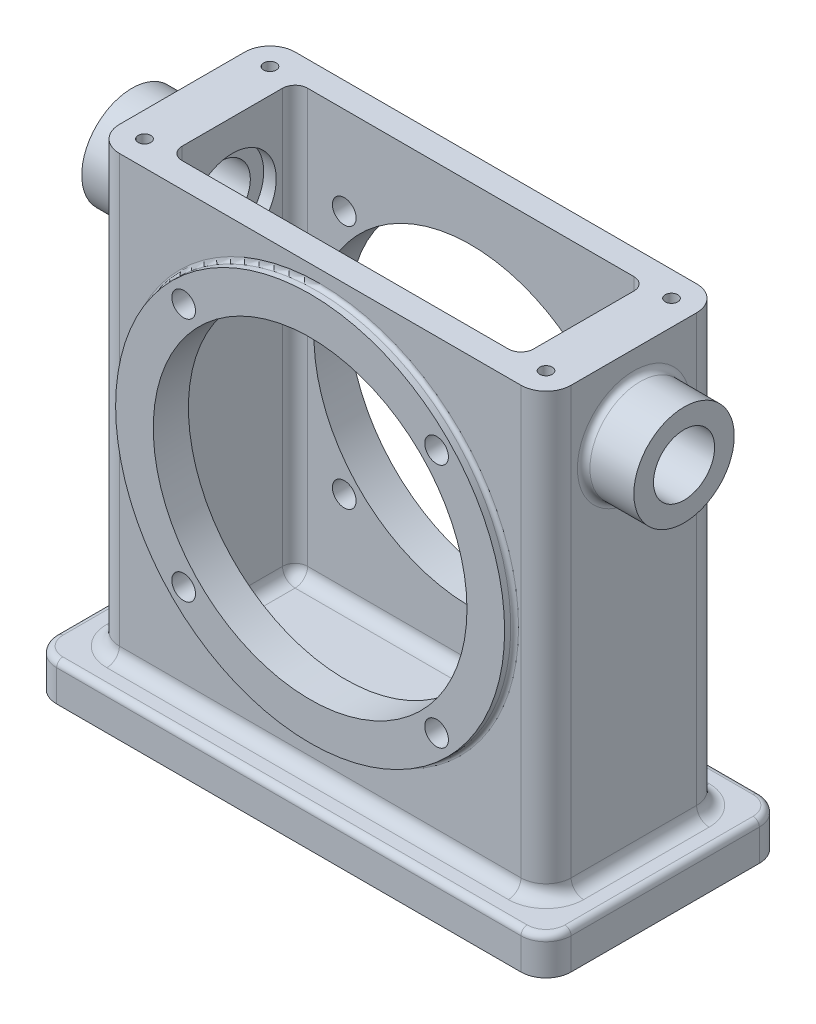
SolidWorks part; units mm, degrees
ref_plane "Front" through (0, 0, 0) normal (0, 0, 1) x (1, 0, 0)
ref_plane "Top" through (0, 0, 0) normal (0, 1, 0) x (1, 0, 0)
ref_plane "Right" through (0, 0, 0) normal (1, 0, 0) x (0, 0, -1)
sketch "Sketch1" plane through (0, 0, 0) normal (0, 1, 0) x (1, 0, 0)
  line L0 (-65.0875, -30.1625) -> (65.0875, 30.1625) construction
  line L1 (-65.0875, -30.1625) -> (65.0875, -30.1625)
  line L2 (-65.0875, -30.1625) -> (-65.0875, 30.1625)
  line L3 (-65.0875, 30.1625) -> (65.0875, 30.1625)
  line L4 (65.0875, -30.1625) -> (65.0875, 30.1625)
  dimension "D1" = 130.175
  dimension "D2" = 60.325
extrude "Base-Extrude" add sketch "Sketch1" along normal blind 9.525
sketch "Sketch2" plane through (0, 9.525, 0) normal (0, 1, 0) x (-1, 0, 0)
  line L0 (57.15, 22.225) -> (-57.15, -22.225) construction
  line L1 (57.15, 22.225) -> (-57.15, 22.225)
  line L2 (57.15, 22.225) -> (57.15, -22.225)
  line L3 (57.15, -22.225) -> (-57.15, -22.225)
  line L4 (-57.15, 22.225) -> (-57.15, -22.225)
  dimension "D1" = 114.3
  dimension "D2" = 44.45
extrude "Boss-Extrude1" add sketch "Sketch2" along normal blind 111.125
fillet "Fillet1" radius 6.35 8 edges at (-57.15, 65.0875, -22.225) (-57.15, 65.0875, 22.225) (57.15, 65.0875, 22.225) (57.15, 65.0875, -22.225) (-65.0875, 4.7625, -30.1625) (65.0875, 4.7625, -30.1625) (65.0875, 4.7625, 30.1625) (-65.0875, 4.7625, 30.1625)
fillet "Fillet2" radius 1.5875 8 edges at (0, 9.525, 30.1625) (-65.0875, 9.525, 0) (65.0875, 9.525, 0) (0, 9.525, -30.1625) (-63.2276, 9.525, -28.3026) (63.2276, 9.525, 28.3026) (63.2276, 9.525, -28.3026) (-63.2276, 9.525, 28.3026)
fillet "Fillet3" radius 3.175 8 edges at (-57.15, 9.525, 0) (0, 9.525, -22.225) (57.15, 9.525, 0) (0, 9.525, 22.225) (-55.2901, 9.525, 20.3651) (-55.2901, 9.525, -20.3651) (55.2901, 9.525, 20.3651) (55.2901, 9.525, -20.3651)
sketch "Sketch3" plane through (0, 120.65, 0) normal (0, 1, 0) x (-1, 0, 0)
  line L2 (50.8, 15.875) -> (-50.8, 15.875)
  line L3 (41.275, 15.875) -> (-41.275, 15.875)
  line L5 (-50.8, -15.875) -> (50.8, -15.875)
  line L6 (-41.275, -15.875) -> (41.275, -15.875)
  line L8 (44.45, -15.875) -> (44.45, 15.875)
  line L9 (44.45, -12.7) -> (44.45, 12.7)
  line L11 (-44.45, 15.875) -> (-44.45, -15.875)
  line L12 (-44.45, 12.7) -> (-44.45, -12.7)
  arc A0 (-41.275, 15.875) -> (-44.45, 12.7) centre (-41.275, 12.7) ccw
  arc A1 (44.45, 12.7) -> (41.275, 15.875) centre (41.275, 12.7) ccw
  arc A2 (41.275, -15.875) -> (44.45, -12.7) centre (41.275, -12.7) ccw
  arc A3 (-44.45, -12.7) -> (-41.275, -15.875) centre (-41.275, -12.7) ccw
  dimension "D5" = 3.175
  dimension "D1" = 6.35
  dimension "D2" = 6.35
  dimension "D3" = 12.7
  dimension "D4" = 12.7
extrude "Cut-Extrude1" cut sketch "Sketch3" against normal blind 107.95
fillet "Fillet4" radius 3.175 8 edges at (43.5201, 12.7, 14.9451) (0, 12.7, 15.875) (-43.5201, 12.7, 14.9451) (-44.45, 12.7, 0) (-43.5201, 12.7, -14.9451) (0, 12.7, -15.875) (43.5201, 12.7, -14.9451) (44.45, 12.7, 0)
sketch "Sketch4" plane through (0, 0, 22.225) normal (0, 0, 1) x (1, 0, 0)
  line L0 (-50.8, 120.65) -> (50.8, 120.65) construction
  line L1 (0, -50) -> (0, 50) construction
  circle A0 centre (0, 67.31) radius 49.2125
  dimension "D1" = 98.425
  dimension "D2" = 53.34
extrude "Boss-Extrude2" add sketch "Sketch4" along normal blind 2.54
mirror "Mirror1" about plane through (0, 0, 0) normal (0, 0, 1) of "Boss-Extrude2"
sketch "Sketch5" plane through (0, 0, 24.765) normal (0, 0, 1) x (1, 0, 0)
  circle A0 centre (0, 67.31) radius 39.6875
  dimension "D1" = 79.375
extrude "Cut-Extrude2" cut sketch "Sketch5" against normal through all
fillet "Fillet5" radius 0.9906 2 edges at (-49.2125, 67.31, 22.225) (49.2125, 67.31, -22.225)
sketch "Sketch6" plane through (57.15, 0, 0) normal (1, 0, 0) x (0, 0, -1)
  line L0 (-23.8125, 0) -> (23.8125, 0) construction
  line L1 (0, 101.6) -> (0, 0) construction
  circle A0 centre (0, 101.6) radius 12.7
  dimension "D1" = 25.4
  dimension "D2" = 101.6
extrude "Boss-Extrude3" add sketch "Sketch6" along normal blind 12.7
sketch "Sketch7" plane through (44.45, 0, 0) normal (-1, 0, 0) x (0, 0, 1)
  circle A0 centre (0, 101.6) radius 7.7343
  dimension "D1" = 15.4686
extrude "Cut-Extrude3" cut sketch "Sketch7" against normal through all
sketch "Sketch8" plane through (44.45, 0, 0) normal (-1, 0, 0) x (0, 0, 1)
  circle A0 centre (0, 101.6) radius 11.1125
  dimension "D1" = 22.225
extrude "Cut-Extrude4" cut sketch "Sketch8" against normal blind 3.175
mirror "Mirror3" about plane through (0, 0, 0) normal (1, 0, 0) of "Cut-Extrude4", "Cut-Extrude3", "Boss-Extrude3"
fillet "Fillet6" radius 1.5875 2 edges at (57.15, 101.6, 12.7) (-57.15, 101.6, -12.7)
hole_wizard "Ø6.0 (6) Diameter Hole1" positions "Sketch13" profile "Sketch12" hole size "Ø6.0" standard "Ansi Metric"
sketch "Sketch13" plane through (0, 0, 24.765) normal (0, 0, 1) x (1, 0, 0)
  line L0 (-66.5494, 67.31) -> (75.5633, 67.31) construction
  line L1 (0, 124.8607) -> (0, -4.2107) construction
  point P0 (32, 98.31)
  point P13 (-32, 98.31)
  point P15 (-32, 36.31)
  point P17 (32, 36.31)
  dimension "D1" = 32
  dimension "D2" = 31
sketch "Sketch12" plane through (32, 98.31, 24.765) normal (1, 0, 0) x (0, -1, 0)
  line L0 (0, 0) -> (0, 54.9275)
  line L1 (0, 54.9275) -> (3, 54.9275)
  line L2 (3, 54.9275) -> (3, 0)
  line L5 (3, 0) -> (0, 0)
  line L11 (0, -6.35) -> (0, 107.95) construction
  dimension "Thru Hole Dia." = 6
  dimension "Thru Hole Depth" = 54.9275
sketch "Sketch10" plane through (0, 120.65, 0) normal (0, 1, 0) x (-1, 0, 0)
  line L0 (-41.275, -15.875) -> (41.275, -15.875) construction
  line L1 (41.275, 15.875) -> (-41.275, 15.875) construction
  line L2 (-57.15, 15.875) -> (-57.15, -15.875) construction
  circle A0 centre (-50.8, -15.875) radius 1.5875
  circle A1 centre (-50.8, 15.875) radius 1.5875
  dimension "D1" = 3.175
  dimension "D2" = 6.35
extrude "Cut-Extrude6" cut sketch "Sketch10" against normal blind 19.05
mirror "Mirror4" about plane through (0, 0, 0) normal (1, 0, 0) of "Cut-Extrude6"
